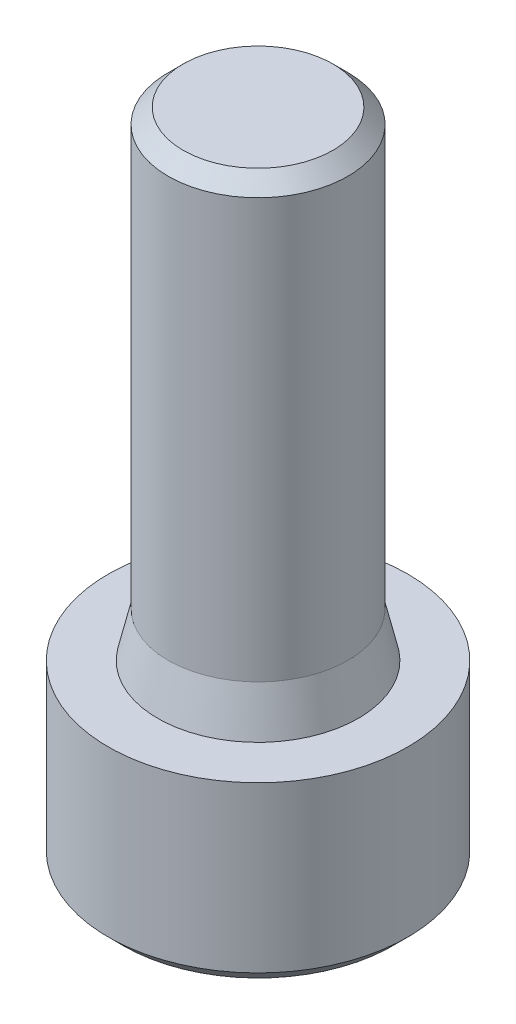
SolidWorks part; units mm, degrees
ref_plane "Piano frontale" through (0, 0, 0) normal (0, 0, 1) x (1, 0, 0)
ref_plane "Piano superiore" through (0, 0, 0) normal (0, 1, 0) x (1, 0, 0)
ref_plane "Piano destro" through (0, 0, 0) normal (1, 0, 0) x (0, 0, -1)
sketch "Schizzo1" plane through (0, 0, 0) normal (1, 0, 0) x (0, 0, -1)
  line L0 (3, 7.5) -> (3.35, 6)
  line L1 (0, 0) -> (5, 0)
  line L2 (0, 0) -> (0, 22)
  line L3 (0, 22) -> (3, 22)
  line L4 (5, 0) -> (5, 6)
  line L6 (3, 22) -> (3, 7.5)
  line L7 (3.35, 6) -> (5, 6)
  dimension "D1" = 5
  dimension "D2" = 3
  dimension "D3" = 3.35
  dimension "D4" = 6
  dimension "D5" = 1.5
  dimension "D6" = 16
revolve "Rivoluzione1" add sketch "Schizzo1" angle 360 about L2
chamfer "Smusso1" distance 0.5 angle 45 2 edges at (0, 0, -5) (0, 22, -3)
sketch "Schizzo2" plane through (0, 0, 0) normal (0, -1, 0) x (1, 0, 0)
  line L1 (-1.4434, 2.5) -> (-2.8868, 0)
  line L2 (-2.8868, 0) -> (-1.4434, -2.5)
  line L3 (-1.4434, -2.5) -> (1.4434, -2.5)
  line L4 (1.4434, -2.5) -> (2.8868, 0)
  line L5 (2.8868, 0) -> (1.4434, 2.5)
  line L6 (1.4434, 2.5) -> (-1.4434, 2.5)
  circle A0 centre (0, 0) radius 2.5 construction
  dimension "D1" = 5
extrude "Taglio-Estrusione1" cut sketch "Schizzo2" against normal blind 4
sketch "Schizzo3" plane through (0, 0, 0) normal (1, 0, 0) x (0, 0, -1)
  line L0 (0, 0) -> (0, -3.4377) construction
  line L1 (0, 0) -> (-1, 0) construction
  line L2 (-4.5, 0) -> (4.5, 0) construction
  line L3 (-1, 0) -> (-3, 0)
  line L4 (-3, 0) -> (-1, 0.3527)
  line L5 (-1, 0.3527) -> (-1, 0)
  dimension "D1" = 3
  dimension "D2" = 10
  dimension "D3" = 2
revolve "Taglia-Rivoluzione1" cut sketch "Schizzo3" angle 360 about L0
